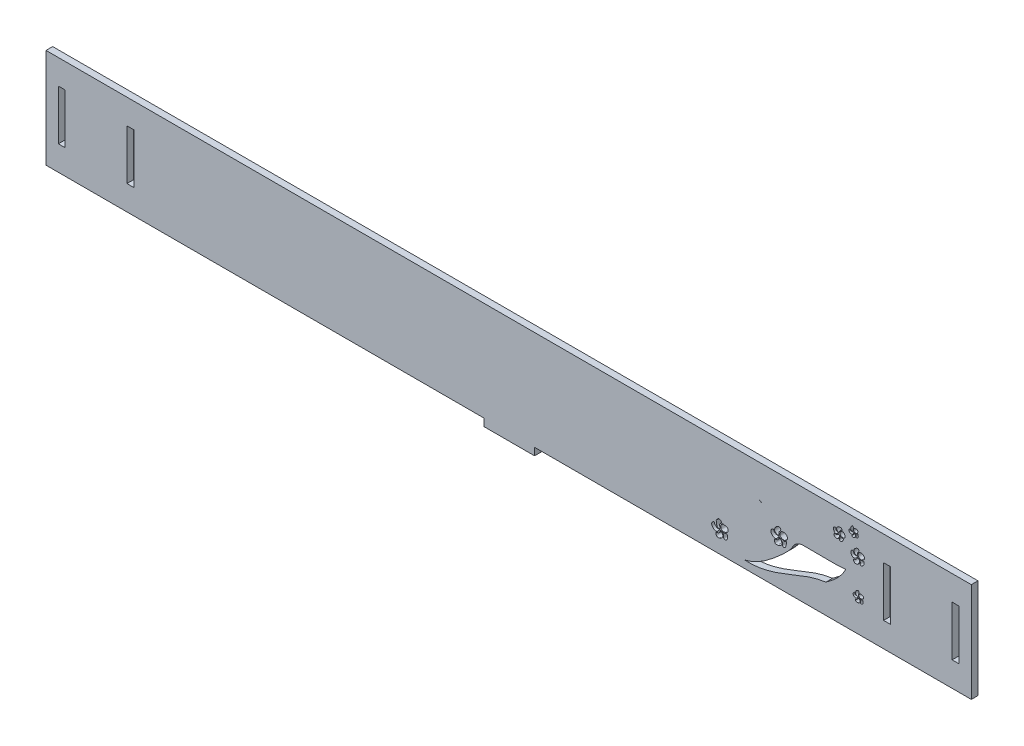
SolidWorks part; units mm, degrees
ref_plane "Alzado" through (0, 0, 0) normal (0, 0, 1) x (1, 0, 0)
ref_plane "Planta" through (0, 0, 0) normal (0, 1, 0) x (1, 0, 0)
ref_plane "Vista lateral" through (0, 0, 0) normal (1, 0, 0) x (0, 0, -1)
sketch "Sketch1" plane through (0, 0, 0) normal (0, 0, 1) x (1, 0, 0)
  line L0 (-67.1933, 20.12) -> (-67.1933, -20.12) construction
  line L1 (187.2438, -20.12) -> (10.48, -20.12)
  line L3 (187.2438, 20.12) -> (-187.2438, 20.12)
  line L5 (187.2438, -20.12) -> (-187.2438, 20.12) construction
  line L6 (187.2438, 20.12) -> (-187.2438, -20.12) construction
  line L7 (-20.0695, 20.12) -> (-20.0695, -20.12) construction
  line L8 (0, 20.12) -> (0, -23.12) construction
  line L9 (20.0695, 20.12) -> (20.0695, -20.12) construction
  line L10 (67.1933, 20.12) -> (67.1933, -20.12) construction
  line L11 (-67.1933, 0) -> (135.9486, 0) construction
  line L12 (-67.1933, -20.12) -> (-67.1933, -2)
  line L13 (-65.1933, 18.12) -> (-65.1933, -18.12)
  line L14 (-67.1933, 20.12) -> (-67.1933, 2)
  line L15 (-63.1933, 20.12) -> (-63.1933, 2)
  line L16 (-63.1933, -20.12) -> (-63.1933, -2)
  line L17 (-59.1933, 20.12) -> (-59.1933, 2)
  line L18 (-59.1933, -20.12) -> (-59.1933, -2)
  line L19 (-55.1933, 20.12) -> (-55.1933, 2)
  line L20 (-55.1933, -20.12) -> (-55.1933, -2)
  line L21 (-51.1933, 20.12) -> (-51.1933, 2)
  line L22 (-51.1933, -20.12) -> (-51.1933, -2)
  line L23 (-47.1933, 20.12) -> (-47.1933, 2)
  line L24 (-47.1933, -20.12) -> (-47.1933, -2)
  line L25 (-43.1933, 20.12) -> (-43.1933, 2)
  line L26 (-43.1933, -20.12) -> (-43.1933, -2)
  line L27 (-39.1933, 20.12) -> (-39.1933, 2)
  line L28 (-39.1933, -20.12) -> (-39.1933, -2)
  line L29 (-35.1933, 20.12) -> (-35.1933, 2)
  line L30 (-35.1933, -20.12) -> (-35.1933, -2)
  line L31 (-31.1933, 20.12) -> (-31.1933, 2)
  line L32 (-31.1933, -20.12) -> (-31.1933, -2)
  line L33 (-27.1933, 20.12) -> (-27.1933, 2)
  line L34 (-27.1933, -20.12) -> (-27.1933, -2)
  line L35 (-23.1933, 20.12) -> (-23.1933, 2)
  line L36 (-23.1933, -20.12) -> (-23.1933, -2)
  line L37 (-19.1933, 20.12) -> (-19.1933, 2)
  line L38 (-19.1933, -20.12) -> (-19.1933, -2)
  line L39 (-61.1933, 18.12) -> (-61.1933, -18.12)
  line L40 (-57.1933, 18.12) -> (-57.1933, -18.12)
  line L41 (-53.1933, 18.12) -> (-53.1933, -18.12)
  line L42 (-49.1933, 18.12) -> (-49.1933, -18.12)
  line L43 (-45.1933, 18.12) -> (-45.1933, -18.12)
  line L44 (-41.1933, 18.12) -> (-41.1933, -18.12)
  line L45 (-37.1933, 18.12) -> (-37.1933, -18.12)
  line L46 (-33.1933, 18.12) -> (-33.1933, -18.12)
  line L47 (-29.1933, 18.12) -> (-29.1933, -18.12)
  line L48 (-25.1933, 18.12) -> (-25.1933, -18.12)
  line L49 (-21.1933, 18.12) -> (-21.1933, -18.12)
  line L50 (19.1933, -20.12) -> (19.1933, -2)
  line L51 (19.1933, 20.12) -> (19.1933, 2)
  line L52 (21.1933, 18.12) -> (21.1933, -18.12)
  line L53 (23.1933, -20.12) -> (23.1933, -2)
  line L54 (23.1933, 20.12) -> (23.1933, 2)
  line L55 (25.1933, 18.12) -> (25.1933, -18.12)
  line L56 (27.1933, 20.12) -> (27.1933, 2)
  line L57 (27.1933, -20.12) -> (27.1933, -2)
  line L58 (29.1933, 18.12) -> (29.1933, -18.12)
  line L59 (31.1933, -20.12) -> (31.1933, -2)
  line L60 (31.1933, 20.12) -> (31.1933, 2)
  line L61 (35.1933, 20.12) -> (35.1933, 2)
  line L62 (35.1933, -20.12) -> (35.1933, -2)
  line L63 (33.1933, 18.12) -> (33.1933, -18.12)
  line L64 (37.1933, 18.12) -> (37.1933, -18.12)
  line L65 (43.1933, -20.12) -> (43.1933, -2)
  line L66 (43.1933, 20.12) -> (43.1933, 2)
  line L67 (39.1933, 20.12) -> (39.1933, 2)
  line L68 (39.1933, -20.12) -> (39.1933, -2)
  line L69 (41.1933, 18.12) -> (41.1933, -18.12)
  line L70 (45.1933, 18.12) -> (45.1933, -18.12)
  line L71 (47.1933, 20.12) -> (47.1933, 2)
  line L72 (47.1933, -20.12) -> (47.1933, -2)
  line L73 (49.1933, 18.12) -> (49.1933, -18.12)
  line L74 (51.1933, -20.12) -> (51.1933, -2)
  line L75 (51.1933, 20.12) -> (51.1933, 2)
  line L76 (53.1933, 18.12) -> (53.1933, -18.12)
  line L77 (55.1933, 20.12) -> (55.1933, 2)
  line L78 (55.1933, -20.12) -> (55.1933, -2)
  line L79 (57.1933, 18.12) -> (57.1933, -18.12)
  line L80 (59.1933, 20.12) -> (59.1933, 2)
  line L81 (59.1933, -20.12) -> (59.1933, -2)
  line L82 (61.1933, 18.12) -> (61.1933, -18.12)
  line L83 (63.1933, -20.12) -> (63.1933, -2)
  line L84 (63.1933, 20.12) -> (63.1933, 2)
  line L85 (65.1933, 18.12) -> (65.1933, -18.12)
  line L86 (67.1933, -20.12) -> (67.1933, -2)
  line L87 (67.1933, 20.12) -> (67.1933, 2)
  line L97 (-10, -20.12) -> (-187.2438, -20.12)
  line L99 (-10, -20.12) -> (-10, -23.12)
  line L100 (-10, -23.12) -> (10.48, -23.12)
  line L101 (10.48, -20.12) -> (10.48, -23.12)
  line L102 (-496.0966, -143.7385) -> (50.57, -143.7385) construction
  line L103 (-187.2438, 20.12) -> (-187.2438, -20.12)
  line L104 (187.2438, 20.12) -> (187.2438, -20.12)
  line L105 (-67.1933, 0) -> (-187.2439, 0) construction
  line L106 (135.9486, 0) -> (187.2439, 0) construction
  line L107 (154.4839, 10.0695) -> (151.7238, 10.0695)
  line L108 (-179.4838, -10.12) -> (-182.2439, -10.12)
  line L109 (-179.4838, -10.12) -> (-179.4838, 10.12)
  line L110 (-179.4838, 10.12) -> (-182.2439, 10.12)
  line L111 (-182.2439, -10.12) -> (-182.2439, 10.12)
  line L112 (-179.4838, -10.12) -> (-182.2439, 10.12) construction
  line L113 (-179.4838, 10.12) -> (-182.2439, -10.12) construction
  line L114 (-154.4839, 10.0695) -> (-151.7238, 10.0695)
  line L115 (-154.4839, 10.0695) -> (-154.4839, -10.1705)
  line L116 (-154.4839, -10.1705) -> (-151.7238, -10.1705)
  line L117 (-151.7238, 10.0695) -> (-151.7238, -10.1705)
  line L118 (151.7238, 10.0695) -> (151.7238, -10.1705)
  line L119 (154.4839, -10.1705) -> (151.7238, -10.1705)
  line L120 (154.4839, 10.0695) -> (154.4839, -10.1705)
  line L121 (179.4838, 10.12) -> (182.2439, 10.12)
  line L122 (179.4838, -10.12) -> (179.4838, 10.12)
  line L123 (179.4838, -10.12) -> (182.2439, -10.12)
  line L124 (182.2439, -10.12) -> (182.2439, 10.12)
  spline S0 degree 3 poles (72.5055, -8.2091) (75.5811, -13.0962) (83.0045, -16.0629) (96.7754, -18.6394) (109.1582, -9.5837) (118.9794, 0.4386) (120.2499, 15.6649) (103.545, 16.3819) (104.67, 5.2711) (110.2929, 3.1919) (112.7147, 6.0708) knots 0 0 0 0 0.173574 0.252148 0.43876 0.620395 0.709465 0.84924 0.908513 1 1 1 1
  spline S1 degree 3 poles (102.6069, -13.9776) (104.9957, -9.4802) (109.091, 7.1143) (96.3781, 8.5804) (93.299, 7.9497) knots 0 0 0 0 0.678241 1 1 1 1
  spline S2 degree 3 poles (89.5812, -17.2044) (97.5692, -14.4906) (99.2808, -8.8014) (98.1565, 6.4778) (90.6312, 4.5113) (89.5812, 2.6731) knots 0 0 0 0 0.490466 0.802076 1 1 1 1
  spline S3 degree 3 poles (115.7261, -1.9595) (119.0429, 2.8191) (112.632, 5.1916) (114.5936, 9.5781) knots 0 0 0 0 1 1 1 1
  spline S4 degree 2 poles (119.1382, 6.0708) (122.947, 14.08) (130.5019, 12.5844) knots 0 0 0 1 1 1
  spline S5 degree 3 poles (108.72, -1.8207) (109.6317, -1.8735) (108.8142, -2.7649) (108.2438, -3.431) (106.9244, -3.2322) (106.1236, -2.1964) (106.0404, -0.9606) (107.1267, -0.3129) (107.3375, -0.9477) (107.6315, -1.3843) (108.1887, -1.6873) (108.72, -1.8207) (109.6317, -1.8735) (108.8142, -2.7649) knots -0.199906 -0.120575 -0.069261 0 0.09578 0.191018 0.317376 0.467957 0.603301 0.699208 0.733226 0.800094 0.879425 0.930739 1 1.09578 1.191018 1.317376 only from (109.3062, -1.9595) to (109.3062, -1.9595)
  spline S6 degree 3 poles (110.3145, -2.8665) (109.5841, -1.8058) (109.194, -3.0274) (108.6213, -3.6362) (107.5425, -3.5206) (107.6209, -4.3919) (107.7703, -5.2617) (109.0117, -5.2711) (109.8713, -4.8832) (110.6952, -4.2711) (110.5634, -3.4739) (110.3145, -2.8665) (109.5841, -1.8058) (109.194, -3.0274) knots -0.242585 -0.177372 -0.106968 0 0.083417 0.190077 0.279914 0.333663 0.4301 0.534511 0.659526 0.757415 0.822628 0.893032 1 1.083417 1.190077 1.279914 only from (109.6075, -2.2016) to (109.6075, -2.2016)
  spline S7 degree 3 poles (107.2977, -1.0743) (109.9982, -2.24) (109.0901, -0.169) (110.2443, 0.309) (110.0192, 1.5764) (108.4896, 1.4139) (107.7615, 0.446) (107.2977, -1.0743) (109.9982, -2.24) (109.0901, -0.169) knots -0.506429 -0.342469 -0.228879 0 0.142558 0.262547 0.347103 0.493571 0.657531 0.771121 1 1.142558 1.262547 1.347103 only from (109.433, -1.5141) to (109.433, -1.5141)
  spline S8 degree 3 poles (110.4944, -2.0915) (109.8341, -2.3887) (110.6926, -2.9169) (110.9697, -3.5964) (110.5788, -4.4652) (111.5513, -4.997) (112.1192, -4.2622) (112.3342, -3.5372) (112.5544, -1.8136) (111.6895, -2.622) (110.965, -2.5583) (110.4944, -2.0915) (109.8341, -2.3887) (110.6926, -2.9169) knots -0.209639 -0.117817 -0.029363 0 0.092594 0.185759 0.27965 0.379187 0.456818 0.562892 0.722151 0.790361 0.882183 0.970637 1 1.092594 1.185759 1.27965 only from (110.0829, -2.3068) to (110.0829, -2.3068)
  spline S9 degree 3 poles (110.0698, 0.2642) (109.8458, -0.6542) (109.5539, -1.5752) (110.6395, -2.0511) (111.7564, -2.456) (112.9022, -1.4474) (112.7615, 0.081) (111.3524, 0.7191) (110.0698, 0.2642) (109.8458, -0.6542) (109.5539, -1.5752) knots -0.382771 -0.208692 -0.069995 0 0.106527 0.195929 0.34351 0.489059 0.617229 0.791308 0.930005 1 1.106527 1.195929 1.34351 only from (109.861, -0.563) to (109.861, -0.563)
  spline S10 degree 3 poles (114.5936, -3.4705) (116.2548, 0.4754) (120.7423, -0.3034) (127.3022, -0.1241) (133.4787, -0.3624) (142.5418, 0.6435) (148.0916, 6.2257) (148.956, 10.1551) knots 0 0 0 0 0.229439 0.319277 0.499581 0.695786 1 1 1 1
  spline S11 degree 2 poles (121.1693, -0.1241) (124.3354, -0.4877) (125.1049, -3.4705) knots 0 0 0 1 1 1
  spline S12 degree 3 poles (121.1693, -0.1241) (122.3194, 1.666) (129.4081, -0.3888) (129.9189, 3.4447) knots 0 0 0 0 1 1 1 1
  spline S13 degree 2 poles (118.4578, 3.4447) (120.6851, 6.084) (123.9378, 5.1953) knots 0 0 0 1 1 1
  spline S14 degree 2 poles (131.0859, -0.2153) (133.3218, -1.2224) (134.0035, -3.4705) knots 0 0 0 1 1 1
  spline S15 degree 3 poles (95.4285, -17.1041) (103.6071, -17.6622) (112.6039, -13.2725) (124.4236, -8.9592) (130.9867, -7.9182) (137.2853, -8.61) (143.1351, -10.7101) (147.5086, -12.7185) (148.8101, -15.1548) knots 0 0 0 0 0.413764 0.525138 0.667073 0.7618 0.856811 1 1 1 1
  spline S16 degree 3 poles (128.3857, -8.4327) (132.0342, -5.9576) (138.0877, -0.4782) (137.1303, 7.8583) (137.1656, 13.6092) (137.5989, 18.0024) (140.9327, 18.7426) knots 0 0 0 0 0.450167 0.622696 0.759547 1 1 1 1
  spline S17 degree 2 poles (137.2128, 8.2002) (138.2555, 10.6185) (140.4221, 11.3951) knots 0 0 0 1 1 1
  spline S18 degree 2 poles (137.2128, 2.6731) (135.7576, 5.4206) (133.2741, 5.1953) knots 0 0 0 1 1 1
  spline S19 degree 3 poles (102.819, 6.0708) (99.5042, 7.6798) (98.1335, 12.3618) (99.795, 15.5526) knots 0 0 0 0 1 1 1 1
  spline S20 degree 3 poles (101.2959, 7.0729) (98.8553, 9.5246) (95.0381, 10.0261) (90.2922, 12.8474) (90.6776, 14.4586) knots 0 0 0 0 0.672736 1 1 1 1
  spline S21 degree 3 poles (93.673, 11.0799) (89.297, 11.6822) (83.1739, 7.5996) (82.6792, -0.1498) (84.9597, -4.5892) (89.367, -7.1698) (94.1153, -6.4386) (97.6473, -2.4156) (96.9915, 1.7855) (95.4285, 3.4447) knots 0 0 0 0 0.304862 0.41325 0.526092 0.642596 0.753116 0.83741 1 1 1 1
  spline S22 degree 2 poles (105.3242, -5.0776) (104.3716, -0.3274) (99.9408, 0) knots 0 0 0 1 1 1
  spline S23 degree 3 poles (135.6243, 12.6636) (134.5566, 12.6572) (133.7294, 11.7351) (134.4612, 10.63) (135.4579, 10.5286) (136.3132, 11.0123) (136.0995, 11.9095) (135.6243, 12.6636) (134.5566, 12.6572) (133.7294, 11.7351) knots -0.375055 -0.270277 -0.10222 0 0.190555 0.339296 0.515541 0.624945 0.729723 0.89778 1 1.190555 1.339296 1.515541 only from (134.7771, 12.5844) to (134.7771, 12.5844)
  spline S24 degree 3 poles (134.1394, 13.7369) (133.4307, 13.5754) (132.6373, 13.0139) (132.7088, 12.0597) (133.6503, 11.3757) (133.8356, 12.1521) (134.1354, 12.675) (134.9665, 12.5986) (134.9425, 13.6007) (134.1394, 13.7369) (133.4307, 13.5754) (132.6373, 13.0139) knots -0.33675 -0.217104 -0.13382 0 0.128991 0.270691 0.402642 0.471459 0.577971 0.66325 0.782896 0.86618 1 1.128991 1.270691 1.402642 only from (133.4267, 13.5103) to (133.4267, 13.5103)
  spline S25 degree 3 poles (132.689, 12.819) (131.9532, 12.7332) (131.3262, 12.351) (131.4867, 11.4642) (131.8821, 10.6132) (132.7565, 10.6739) (133.706, 11.2656) (132.8814, 11.6261) (132.335, 11.9944) (132.689, 12.819) (131.9532, 12.7332) (131.3262, 12.351) knots -0.253332 -0.160894 -0.053614 0 0.120817 0.267391 0.373579 0.534133 0.642234 0.746668 0.839106 0.946386 1 1.120817 1.267391 1.373579 only from (132.1396, 12.7391) to (132.1396, 12.7391)
  spline S26 degree 3 poles (132.6044, 10.3488) (131.8115, 10.6102) (131.6167, 9.877) (131.9745, 9.2476) (132.7911, 8.9947) (133.4328, 9.3677) (133.9582, 9.8108) (134.0272, 10.5166) (133.5981, 10.9026) (133.1369, 10.5567) (132.6044, 10.3488) (131.8115, 10.6102) (131.6167, 9.877) knots -0.291984 -0.22885 -0.098301 0 0.093634 0.177257 0.340726 0.435004 0.526354 0.669426 0.708016 0.77115 0.901699 1 1.093634 1.177257 1.340726 only from (131.8882, 10.4392) to (131.8882, 10.4392)
  spline S27 degree 3 poles (134.5142, 10.5306) (133.9738, 10.9872) (134.1333, 10.4668) (134.1686, 10.149) (134.1046, 9.7439) (133.8794, 9.4367) (133.8955, 9.0361) (134.3019, 8.7194) (134.8851, 8.9645) (135.2505, 9.4521) (135.4808, 9.9105) (135.3603, 10.4467) (134.7999, 10.2358) (134.5142, 10.5306) (133.9738, 10.9872) (134.1333, 10.4668) knots -0.246654 -0.16516 -0.077747 0 0.051496 0.11706 0.193334 0.251766 0.313752 0.382339 0.485779 0.600045 0.702107 0.753346 0.83484 0.922253 1 1.051496 1.11706 1.193334 only from (134.0632, 10.819) to (134.0632, 10.819)
  spline S28 degree 3 poles (141.1968, 7.6453) (141.3751, 6.8333) (140.4192, 7.2645) (139.8613, 7.6125) (139.6515, 8.3728) (139.9187, 9.0492) (140.427, 9.4444) (140.899, 9.7637) (141.4472, 9.8003) (141.7948, 9.38) (141.7425, 8.8494) (141.255, 8.6601) (141.229, 8.1011) (141.1968, 7.6453) (141.3751, 6.8333) (140.4192, 7.2645) knots -0.209649 -0.141261 -0.070491 0 0.097571 0.200859 0.292317 0.37977 0.477284 0.544714 0.60742 0.676148 0.735418 0.790351 0.858739 0.929509 1 1.097571 1.200859 1.292317 only from (141.2286, 7.0729) to (141.2286, 7.0729)
  spline S29 degree 3 poles (142.2004, 6.6451) (141.4151, 7.0124) (141.4371, 7.9499) (141.7096, 8.7715) (142.4771, 8.9232) (143.1293, 8.9134) (143.6132, 8.5243) (144.0006, 8.1545) (144.1586, 7.54) (143.727, 7.0857) (143.3357, 6.7504) (142.8267, 6.5074) (142.2004, 6.6451) (141.4151, 7.0124) (141.4371, 7.9499) knots -0.242864 -0.187923 -0.100135 0 0.114408 0.225493 0.303072 0.397057 0.471281 0.536043 0.606289 0.689605 0.757136 0.812077 0.899865 1 1.114408 1.225493 1.303072 only from (141.5767, 7.0729) to (141.5767, 7.0729)
  spline S30 degree 3 poles (142.3832, 6.3404) (141.3958, 6.7348) (141.9953, 6.3537) (142.1425, 6.0751) (142.2434, 5.7033) (142.3984, 5.2766) (142.0868, 4.7435) (142.7202, 4.3119) (143.3524, 4.677) (143.8514, 5.3095) (143.905, 6.8539) (143.2236, 6.4238) (142.8141, 6.2773) (142.3832, 6.3404) (141.3958, 6.7348) (141.9953, 6.3537) knots -0.219919 -0.174992 -0.09371 0 0.053684 0.09658 0.141516 0.210716 0.27882 0.353977 0.446763 0.545132 0.727733 0.780081 0.825008 0.90629 1 1.053684 1.09658 1.141516 only from (141.6679, 6.5818) to (141.6679, 6.5818)
  spline S31 degree 3 poles (141.6376, 6.2333) (141.3382, 6.8334) (141.1095, 6.2482) (140.8865, 5.9354) (140.5048, 5.5989) (140.106, 5.3801) (139.3635, 5.3261) (139.705, 4.3053) (140.5029, 3.9895) (141.312, 4.2178) (141.8609, 4.7136) (142.1172, 5.2797) (142.016, 5.9407) (141.6376, 6.2333) (141.3382, 6.8334) (141.1095, 6.2482) knots -0.2105 -0.131175 -0.046133 0 0.052215 0.116133 0.175167 0.241763 0.300462 0.418363 0.506127 0.631299 0.721071 0.7895 0.868825 0.953867 1 1.052215 1.116133 1.175167 only from (141.353, 6.6647) to (141.353, 6.6647)
  spline S32 degree 3 poles (140.2836, 6.8516) (141.4052, 7.0836) (140.7918, 6.2955) (140.4204, 5.9208) (139.7697, 5.6953) (139.1362, 5.8458) (138.6927, 6.3403) (138.478, 6.9231) (138.3882, 7.5846) (138.7534, 8.0069) (139.2452, 8.2314) (139.595, 7.7743) (139.7693, 7.292) (140.2836, 6.8516) (141.4052, 7.0836) (140.7918, 6.2955) knots -0.258232 -0.18269 -0.113635 0 0.069441 0.158697 0.229312 0.320521 0.393057 0.475982 0.562543 0.630119 0.682826 0.741768 0.81731 0.886365 1 1.069441 1.158697 1.229312 only from (141.1292, 6.8553) to (141.1292, 6.8553)
  spline S33 degree 3 poles (140.8376, 16.4568) (139.6857, 16.2706) (139.6201, 15.4945) (139.6292, 14.9637) (140.2061, 14.6789) (140.8238, 14.7735) (141.2534, 15.1952) (141.4512, 15.7746) (140.8376, 16.4568) (139.6857, 16.2706) (139.6201, 15.4945) knots -0.465021 -0.370034 -0.240705 0 0.09695 0.194427 0.28527 0.432486 0.534979 0.629966 0.759295 1 1.09695 1.194427 1.28527 only from (139.7285, 15.9757) to (139.7285, 15.9757)
  spline S34 degree 3 poles (139.3292, 16.7371) (139.6938, 16.1978) (139.2024, 15.7317) (139.483, 15.2795) (139.3951, 14.7135) (138.9086, 14.8536) (138.5651, 15.0114) (138.404, 15.4535) (138.4381, 15.8915) (138.6753, 16.2996) (138.8815, 16.6343) (139.3292, 16.7371) (139.6938, 16.1978) (139.2024, 15.7317) knots -0.260225 -0.168679 -0.118353 0 0.104725 0.223158 0.304217 0.372464 0.479984 0.53643 0.651334 0.739775 0.831321 0.881647 1 1.104725 1.223158 1.304217 only from (139.5379, 16.2091) to (139.5379, 16.2091)
  spline S35 degree 3 poles (138.4716, 14.5525) (138.3452, 15.0613) (137.8889, 15.1176) (137.6732, 14.645) (137.7582, 14.0692) (138.2994, 13.66) (139.04, 13.5006) (139.4185, 14.0104) (139.5794, 14.6437) (138.9887, 14.6139) (138.4716, 14.5525) (138.3452, 15.0613) (137.8889, 15.1176) knots -0.264651 -0.190126 -0.070092 0 0.07007 0.13498 0.27017 0.38096 0.521231 0.65281 0.735349 0.809874 0.929908 1 1.07007 1.13498 1.27017 only from (138.2842, 15.0024) to (138.2842, 15.0024)
  spline S36 degree 3 poles (140.0983, 14.4814) (139.6757, 14.5267) (139.6121, 14.2061) (139.5296, 13.8482) (139.2305, 13.5227) (138.78, 13.3753) (138.946, 12.8664) (139.5121, 12.7203) (140.0201, 13.0183) (140.5022, 13.4164) (140.3933, 14.0565) (140.0983, 14.4814) (139.6757, 14.5267) (139.6121, 14.2061) knots -0.275974 -0.180698 -0.024774 0 0.046365 0.131965 0.238954 0.300177 0.377166 0.476897 0.614689 0.724026 0.819302 0.975226 1 1.046365 1.131965 1.238954 only from (139.7285, 14.503) to (139.7285, 14.503)
  spline S37 degree 3 poles (140.6507, 14.4034) (140.0453, 14.5268) (140.6617, 14.2099) (140.7005, 13.8344) (140.5959, 13.4439) (140.9449, 13.2072) (141.3496, 13.5095) (141.5381, 14.0059) (141.4269, 14.422) (141.2631, 14.9922) (140.8861, 14.6081) (140.6507, 14.4034) (140.0453, 14.5268) (140.6617, 14.2099) knots -0.250432 -0.157811 -0.084611 0 0.07402 0.202265 0.260051 0.324791 0.428052 0.549514 0.664213 0.749568 0.842189 0.915389 1 1.07402 1.202265 1.260051 only from (140.2324, 14.4586) to (140.2324, 14.4586)
  spline S38 degree 3 poles (117.1844, -3.3299) (116.7323, -2.5045) (115.7884, -2.8973) (115.6736, -3.7903) (115.8638, -4.7602) (117.4703, -4.9347) (116.6792, -3.945) (117.1844, -3.3299) (116.7323, -2.5045) (115.7884, -2.8973) knots -0.371748 -0.24987 -0.114885 0 0.127797 0.300009 0.439602 0.628252 0.75013 0.885115 1 1.127797 1.300009 1.439602 only from (116.6891, -2.7031) to (116.6891, -2.7031)
  spline S39 degree 3 poles (118.267, -2.8046) (117.0665, -3.1834) (117.1486, -4.957) (118.6881, -4.8293) (119.1479, -3.9913) (119.3047, -3.0513) (118.267, -2.8046) (117.0665, -3.1834) (117.1486, -4.957) knots -0.448019 -0.329983 -0.228971 0 0.197262 0.389622 0.551981 0.670017 0.771029 1 1.197262 1.389622 1.551981 only from (117.2907, -3.4705) to (117.2907, -3.4705)
  spline S40 degree 3 poles (118.2801, -4.852) (118.2972, -5.2153) (118.6488, -5.3369) (118.7278, -5.7271) (118.7954, -6.2382) (119.4842, -6.1244) (119.7159, -5.5994) (119.7219, -5.0523) (119.566, -4.6419) (119.2377, -4.2812) (118.9295, -4.6624) (118.6878, -4.9289) (118.2801, -4.852) (118.2972, -5.2153) (118.6488, -5.3369) knots -0.175692 -0.100736 -0.033639 0 0.077174 0.161125 0.234222 0.35427 0.452345 0.574788 0.677754 0.732917 0.824308 0.899264 0.966361 1 1.077174 1.161125 1.234222 only from (118.3105, -5.1119) to (118.3105, -5.1119)
  spline S41 degree 3 poles (117.5089, -4.9449) (117.9079, -5.1459) (118.2136, -5.343) (118.4753, -5.8061) (118.5377, -6.3342) (118.2401, -6.6294) (118.0522, -6.8733) (117.6997, -7.1685) (117.1485, -7.1881) (116.7296, -6.8811) (116.6905, -6.4423) (117.0466, -6.1985) (117.3733, -5.8555) (117.3891, -5.4297) (117.5089, -4.9449) (117.9079, -5.1459) (118.2136, -5.343) knots -0.185915 -0.108619 -0.045316 0 0.075066 0.150001 0.264045 0.306629 0.356785 0.42196 0.533927 0.60686 0.667084 0.722538 0.814085 0.891381 0.954684 1 1.075066 1.150001 1.264045 only from (117.8329, -5.1119) to (117.8329, -5.1119)
  spline S42 degree 3 poles (117.2133, -5.534) (117.3456, -4.8749) (116.8813, -4.9172) (116.6266, -5.1025) (116.2804, -4.9379) (115.9087, -4.8271) (115.6144, -4.3996) (115.1421, -4.7108) (114.9241, -5.1171) (115.0554, -5.6211) (115.452, -5.9399) (115.9361, -6.2039) (116.5143, -6.248) (116.9564, -5.9084) (117.2133, -5.534) (117.3456, -4.8749) (116.8813, -4.9172) knots -0.238835 -0.163539 -0.090831 0 0.052781 0.081368 0.148943 0.210117 0.27594 0.354346 0.420275 0.495315 0.580233 0.658183 0.761165 0.836461 0.909169 1 1.052781 1.081368 1.148943 only from (117.1788, -4.9481) to (117.1788, -4.9481)
  spline S43 degree 3 poles (113.3443, -7.7122) (112.4514, -7.994) (111.7652, -8.7588) (112.093, -9.95) (113.4023, -10.149) (114.1375, -9.4672) (114.5159, -8.6759) (114.0778, -8.0969) (113.3443, -7.7122) (112.4514, -7.994) (111.7652, -8.7588) knots -0.345149 -0.264535 -0.184492 0 0.07871 0.237386 0.410345 0.534834 0.654851 0.735465 0.815508 1 1.07871 1.237386 1.410345 only from (112.3023, -8.2091) to (112.3023, -8.2091)
  spline S44 degree 3 poles (110.1796, -8.553) (110.8279, -7.6195) (111.5922, -7.834) (111.9216, -8.311) (111.5872, -8.5504) (111.6109, -8.9288) (111.5981, -9.2387) (111.7754, -9.5776) (112.1093, -9.9222) (111.4778, -10.2974) (110.8139, -10.2649) (110.1153, -9.5817) (110.1796, -8.553) (110.8279, -7.6195) (111.5922, -7.834) knots -0.41414 -0.310745 -0.147945 0 0.102612 0.14943 0.211301 0.235496 0.310937 0.340271 0.405972 0.467518 0.58586 0.689255 0.852055 1 1.102612 1.14943 1.211301 only from (110.9865, -7.7774) to (110.9865, -7.7774)
  spline S45 degree 3 poles (112.0769, -11.2457) (112.1514, -10.336) (111.4511, -10.6744) (110.8198, -10.6194) (110.3927, -10.1096) (109.7124, -10.0449) (109.5777, -10.6547) (109.5743, -11.2394) (110.092, -11.6368) (110.5704, -12.0016) (111.2347, -12.0967) (111.7688, -11.7219) (112.0769, -11.2457) (112.1514, -10.336) (111.4511, -10.6744) knots -0.266451 -0.180101 -0.10465 0 0.047818 0.163027 0.249839 0.323094 0.388106 0.476318 0.559393 0.643529 0.733549 0.819899 0.89535 1 1.047818 1.163027 1.249839 only from (111.9586, -10.4867) to (111.9586, -10.4867)
  spline S46 degree 3 poles (113.1273, -10.7621) (112.7123, -10.4335) (112.2795, -10.5652) (112.4127, -11.0813) (112.1942, -11.5415) (111.8682, -11.9708) (111.4637, -12.5066) (112.0985, -13.0971) (112.992, -12.9274) (113.7389, -12.2506) (113.7787, -11.1638) (113.1273, -10.7621) (112.7123, -10.4335) (112.2795, -10.5652) knots -0.30773 -0.180533 -0.06519 0 0.034136 0.094907 0.180111 0.248055 0.335322 0.416959 0.541319 0.69227 0.819467 0.93481 1 1.034136 1.094907 1.180111 only from (112.6193, -10.4867) to (112.6193, -10.4867)
  spline S47 degree 3 poles (112.7075, -10.2371) (113.2211, -10.4646) (113.5252, -10.5886) (113.789, -11.0039) (114.041, -11.3084) (113.8356, -11.8694) (114.6934, -11.7648) (115.152, -11.0757) (114.9032, -10.317) (114.6972, -9.581) (114.1618, -9.6186) (114.1328, -9.9453) (113.8884, -10.0632) (113.5505, -10.2287) (113.2654, -10.2358) (112.7075, -10.2371) (113.2211, -10.4646) (113.5252, -10.5886) knots -0.152562 -0.072027 -0.034424 0 0.087885 0.145486 0.205752 0.254157 0.347067 0.435687 0.608128 0.676766 0.73728 0.767004 0.80309 0.847438 0.927973 0.965576 1 1.087885 1.145486 1.205752 only from (113.0347, -10.3814) to (113.0347, -10.3814)
  spline S48 degree 3 poles (142.0449, -5.1766) (141.3389, -4.7429) (140.8493, -5.0966) (140.4573, -5.4935) (140.415, -6.0426) (140.4099, -6.6715) (140.9341, -6.8335) (141.636, -7.1351) (141.4107, -6.3014) (141.6069, -5.8123) (142.0449, -5.1766) (141.3389, -4.7429) (140.8493, -5.0966) knots -0.333169 -0.209461 -0.10782 0 0.097677 0.191143 0.285766 0.390179 0.474106 0.573938 0.666831 0.790539 0.89218 1 1.097677 1.191143 1.285766 only from (141.353, -4.8754) to (141.353, -4.8754)
  spline S49 degree 3 poles (142.7648, -5.6458) (142.33, -5.5948) (141.9531, -5.7976) (141.6332, -6.1356) (141.6238, -6.7325) (142.196, -7.2205) (142.984, -7.1769) (143.5912, -6.8084) (143.8076, -6.1782) (143.3063, -5.6638) (142.7648, -5.6458) (142.33, -5.5948) (141.9531, -5.7976) knots -0.287444 -0.175467 -0.061227 0 0.05136 0.161454 0.230397 0.346419 0.513529 0.619195 0.712556 0.824533 0.938773 1 1.05136 1.161454 1.230397 only from (142.3185, -5.6304) to (142.3185, -5.6304)
  spline S50 degree 3 poles (142.2171, -7.4026) (141.8655, -7.3714) (142.2211, -7.6315) (142.3698, -7.8408) (142.4446, -8.1947) (142.419, -8.5068) (142.4761, -8.9827) (143.1359, -8.8415) (143.4213, -8.3922) (143.5187, -7.8928) (143.4905, -7.5285) (143.2832, -7.2614) (143.0151, -7.3984) (142.7841, -7.5995) (142.4245, -7.4932) (142.2171, -7.4026) (141.8655, -7.3714) (142.2211, -7.6315) knots -0.161631 -0.091904 -0.031946 0 0.046629 0.119057 0.184801 0.238324 0.311395 0.406845 0.522699 0.614038 0.695681 0.731874 0.7836 0.838369 0.908096 0.968054 1 1.046629 1.119057 1.184801 only from (141.9663, -7.4) to (141.9663, -7.4)
  spline S51 degree 3 poles (141.9402, -7.4521) (141.5011, -7.2422) (141.4232, -7.7168) (141.1211, -7.9561) (140.8533, -8.3653) (140.1825, -8.2038) (140.396, -8.9394) (140.9075, -9.3319) (141.6765, -9.1269) (142.3839, -8.5783) (142.0912, -7.883) (141.9402, -7.4521) (141.5011, -7.2422) (141.4232, -7.7168) knots -0.243584 -0.136135 -0.039743 0 0.061185 0.13703 0.21141 0.29142 0.380164 0.476645 0.618224 0.756416 0.863865 0.960257 1 1.061185 1.13703 1.21141 only from (141.5767, -7.3237) to (141.5767, -7.3237)
  spline S52 degree 3 poles (140.5934, -6.9957) (141.7189, -6.9512) (141.0523, -7.6081) (140.6253, -8.0745) (139.8204, -7.8343) (139.3811, -7.2201) (139.4287, -6.573) (139.7931, -6.1736) (140.1838, -6.291) (140.0404, -6.6541) (140.5934, -6.9957) (141.7189, -6.9512) (141.0523, -7.6081) knots -0.301075 -0.257297 -0.183349 0 0.090776 0.189915 0.34183 0.449425 0.577206 0.658711 0.698925 0.742703 0.816651 1 1.090776 1.189915 1.34183 only from (141.4027, -7.1709) to (141.4027, -7.1709)
  spline S53 degree 3 poles (85.2105, -10.0691) (85.5277, -9.2402) (86.5552, -8.5697) (85.1549, -7.5908) (84.4812, -8.189) (83.4467, -9.5202) (84.4435, -8.3353) (83.5893, -11.3628) (85.8454, -11.2048) (85.2105, -10.0691) (85.5277, -9.2402) (86.5552, -8.5697) knots -0.312793 -0.199791 -0.108289 0 0.080333 0.207517 0.327643 0.435044 0.463968 0.687207 0.800209 0.891711 1 1.080333 1.207517 1.327643 only from (85.6912, -9.2095) to (85.6912, -9.2095)
  spline S54 degree 3 poles (86.5531, -8.6024) (86.1479, -9.387) (85.7585, -9.8651) (85.9129, -10.4278) (85.8596, -11.2686) (87.0408, -11.5272) (88.015, -11.2821) (89.1426, -10.4921) (88.511, -9.027) (87.4835, -9.0495) (86.5531, -8.6024) (86.1479, -9.387) (85.7585, -9.8651) knots -0.300392 -0.19052 -0.108181 0 0.051732 0.092374 0.189484 0.301367 0.422502 0.551054 0.699608 0.80948 0.891819 1 1.051732 1.092374 1.189484 only from (86.0338, -9.5073) to (86.0338, -9.5073)
  spline S55 degree 3 poles (86.4594, -12.2958) (85.6025, -11.2294) (85.5681, -12.5019) (84.8687, -13.0261) (83.7727, -12.9955) (83.8504, -13.9193) (84.3004, -14.6833) (85.4919, -14.5587) (86.4523, -14.0414) (86.781, -13.0034) (86.4594, -12.2958) (85.6025, -11.2294) (85.5681, -12.5019) knots -0.292832 -0.196609 -0.110161 0 0.075265 0.187027 0.289938 0.357126 0.446991 0.565876 0.707168 0.803391 0.889839 1 1.075265 1.187027 1.289938 only from (85.6912, -11.6295) to (85.6912, -11.6295)
  spline S56 degree 3 poles (86.0046, -11.5817) (86.6354, -11.9022) (87.1721, -12.3251) (86.8096, -13.2605) (87.2421, -14.1887) (88.2487, -13.9658) (88.5345, -13.0392) (88.8289, -12.1408) (88.1086, -11.4785) (87.3646, -12.0011) (86.9033, -11.6387) (86.0046, -11.5817) (86.6354, -11.9022) (87.1721, -12.3251) knots -0.20636 -0.081726 -0.03876 0 0.087949 0.226054 0.303515 0.413972 0.497667 0.652859 0.7169 0.79364 0.918274 0.96124 1 1.087949 1.226054 1.303515 only from (86.4325, -11.8058) to (86.4325, -11.8058)
  spline S57 degree 3 poles (84.1814, -11.7345) (85.6915, -11.11) (84.8679, -12.3347) (84.1362, -12.8894) (82.9259, -12.5786) (82.3108, -11.6676) (81.9233, -10.6174) (83.445, -9.3751) (83.2145, -10.6582) (83.9468, -10.8409) (84.1814, -11.7345) (85.6915, -11.11) (84.8679, -12.3347) knots -0.243854 -0.18914 -0.104613 0 0.101998 0.185704 0.326434 0.436782 0.54115 0.680555 0.756146 0.81086 0.895387 1 1.101998 1.185704 1.326434 only from (85.2801, -11.4415) to (85.2801, -11.4415)
  point P0 (0, 0)
  point P21 (-67.1933, -11.06)
  point P169 (-180.8638, 0)
extrude "Boss-Extrude1" add sketch "Sketch1" along normal blind 2.7
equation "\"kerf\"= 0.24"
equation "\"mwk\"= \"mw\" + \"kerf\""
equation "\"mw\"=2.76"
equation "\"r\"= 30'Radius"
equation "\"C\"= 2 * \"r\" * 3.14159'Circumference"
equation "\"CQ\"= \"C\" / 4'Circle Quarter"
equation "\"dbc\"= 2'Distance between cuts"
equation "\"D4@Sketch1\"=\"CQ\""
equation "\"D5@Sketch1\"=\"dbc\""
equation "\"D1@Sketch1\"=40+\"kerf\""
equation "\"D6@Sketch1\"=\"dbc\""
equation "\"D7@Sketch1\"=\"dbc\""
equation "\"D8@Sketch1\"=\"dbc\""
equation "\"D16@Sketch1\"=\"mwk\""
equation "\"D17@Sketch1\"=20+(\"kerf\"*2)"
equation "\"D2@Sketch1\"=(120*2)+40+(\"CQ\"*2)+\"kerf\""
equation "\"D3@Sketch1\"=\"mw\""
equation "\"D13@Sketch1\"=20+\"kerf\""
equation "\"D19@Sketch1\"=\"mw\""
equation "\"D20@Sketch1\"=20+\"kerf\""
